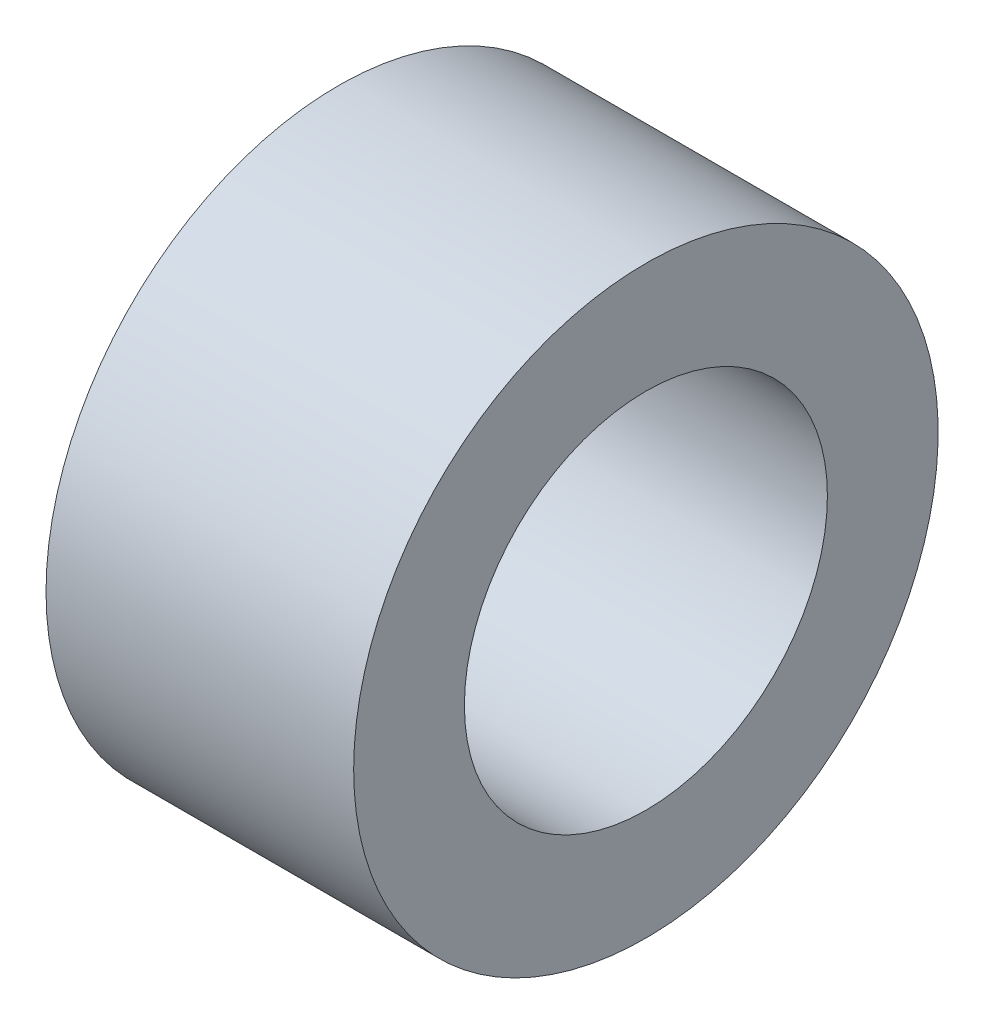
SolidWorks part; units mm, degrees
ref_plane "Plan de face" through (0, 0, 0) normal (0, 0, 1) x (1, 0, 0)
ref_plane "Plan de dessus" through (0, 0, 0) normal (0, 1, 0) x (1, 0, 0)
ref_plane "Plan de droite" through (0, 0, 0) normal (1, 0, 0) x (0, 0, -1)
sketch "Esquisse1" plane through (0, 0, 0) normal (0, 0, 1) x (1, 0, 0)
  line L0 (0, 5.9) -> (0, 9.5)
  line L1 (0, 9.5) -> (10, 9.5)
  line L4 (10, 9.5) -> (10, 5.9)
  line L5 (10, 5.9) -> (0, 5.9)
  line L6 (0, 0) -> (29.9078, 0) construction
  dimension "D1" = 11.8
  dimension "D2" = 19
  dimension "D5" = 10
revolve "Révolution1" add sketch "Esquisse1" angle 360 about L6
